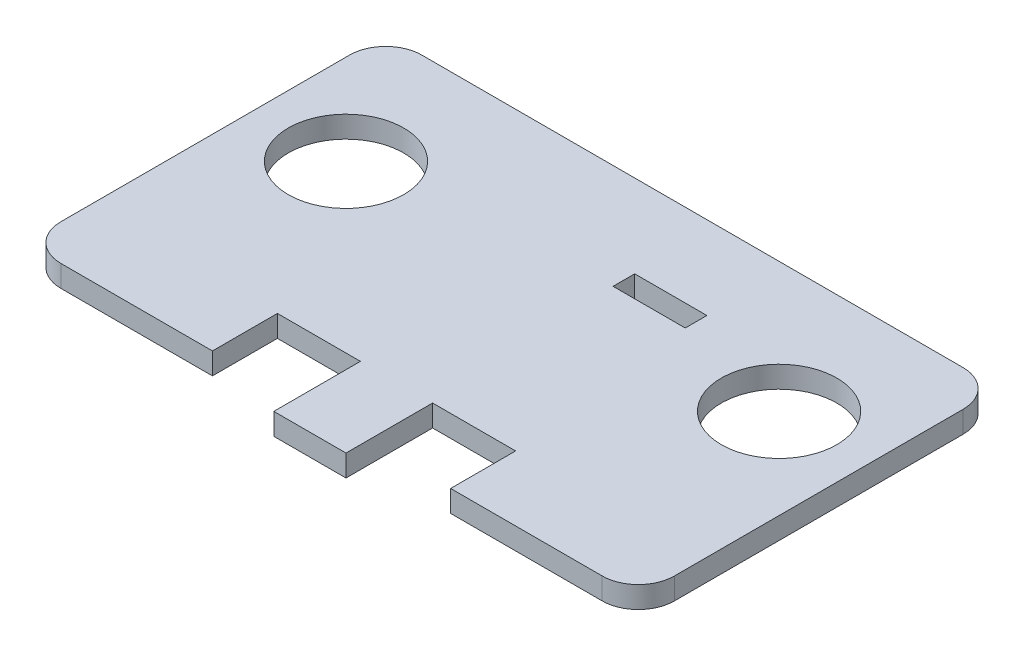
SolidWorks part; units mm, degrees
ref_plane "Front Plane" through (0, 0, 0) normal (0, 0, 1) x (1, 0, 0)
ref_plane "Top Plane" through (0, 0, 0) normal (0, 1, 0) x (1, 0, 0)
ref_plane "Right Plane" through (0, 0, 0) normal (1, 0, 0) x (0, 0, -1)
sketch "Sketch1" plane through (0, 0, 0) normal (0, 1, 0) x (1, 0, 0)
  line L1 (-42.5, 25) -> (42.5, 25)
  line L2 (-42.5, 25) -> (-42.5, -25)
  line L3 (-42.5, -25) -> (42.5, -25)
  line L4 (42.5, 25) -> (42.5, -25)
  line L5 (-42.5, 25) -> (42.5, -25) construction
  line L6 (-42.5, -25) -> (42.5, 25) construction
  point P0 (0, 0)
  dimension "D1" = 85
  dimension "D2" = 50
extrude "Boss-Extrude1" add sketch "Sketch1" along normal blind 3
fillet "Fillet1" radius 5 4 edges at (-42.5, 1.5, -25) (42.5, 1.5, -25) (42.5, 1.5, 25) (-42.5, 1.5, 25)
sketch "Sketch2" plane through (0, 3, 0) normal (0, 1, 0) x (1, 0, 0)
  line L1 (-30, 7) -> (30, 7) construction
  line L2 (37.5, 25) -> (-37.5, 25) construction
  line L3 (0, -1.65) -> (0, 1.65) construction
  circle A0 centre (-30, 7) radius 8
  circle A1 centre (30, 7) radius 8
  dimension "D4" = 16
  dimension "D1" = 18
  dimension "D2" = 30
  dimension "D3" = 30
extrude "Cut-Extrude1" cut sketch "Sketch2" against normal blind 3
sketch "Sketch4" plane through (0, 3, 0) normal (0, 1, 0) x (1, 0, 0)
  line L0 (-37.5, -25) -> (37.5, -25) construction
  line L1 (0, -25) -> (-16.5, -25)
  line L2 (0, -25) -> (0, -16)
  line L3 (0, -16) -> (-16.5, -16)
  line L4 (-16.5, -25) -> (-16.5, -16)
  dimension "D1" = 9
  dimension "D2" = 16.5
extrude "Cut-Extrude2" cut sketch "Sketch4" against normal blind 3
mirror "Mirror1" about plane through (0, 0, 0) normal (1, 0, 0) of "Cut-Extrude2"
sketch "Sketch6" plane through (0, 3, 0) normal (0, 1, 0) x (1, 0, 0)
  line L0 (16.5, -16) -> (-16.5, -16) construction
  line L1 (-5, -16) -> (5, -16)
  line L2 (-5, -16) -> (-5, -28)
  line L3 (-5, -28) -> (5, -28)
  line L4 (5, -16) -> (5, -28)
  line L5 (0, -1.65) -> (0, 1.65) construction
  dimension "D1" = 10
  dimension "D2" = 12
  dimension "D3" = 5
extrude "Boss-Extrude2" add sketch "Sketch6" against normal blind 3 contours L2 L3 L4 L1
sketch "Sketch7" plane through (0, 3, 0) normal (0, 1, 0) x (1, 0, 0)
  line L0 (42.5, -20) -> (42.5, 20) construction
  line L1 (3.5, 13.5) -> (13.5, 13.5)
  line L2 (3.5, 13.5) -> (3.5, 10.5)
  line L3 (3.5, 10.5) -> (13.5, 10.5)
  line L4 (13.5, 13.5) -> (13.5, 10.5)
  line L5 (3.5, 13.5) -> (13.5, 10.5) construction
  line L6 (3.5, 10.5) -> (13.5, 13.5) construction
  line L7 (37.5, 25) -> (-37.5, 25) construction
  point P0 (8.5, 12)
  dimension "D1" = 34
  dimension "D2" = 13
  dimension "D3" = 10
  dimension "D4" = 3
extrude "Cut-Extrude3" cut sketch "Sketch7" against normal blind 3
